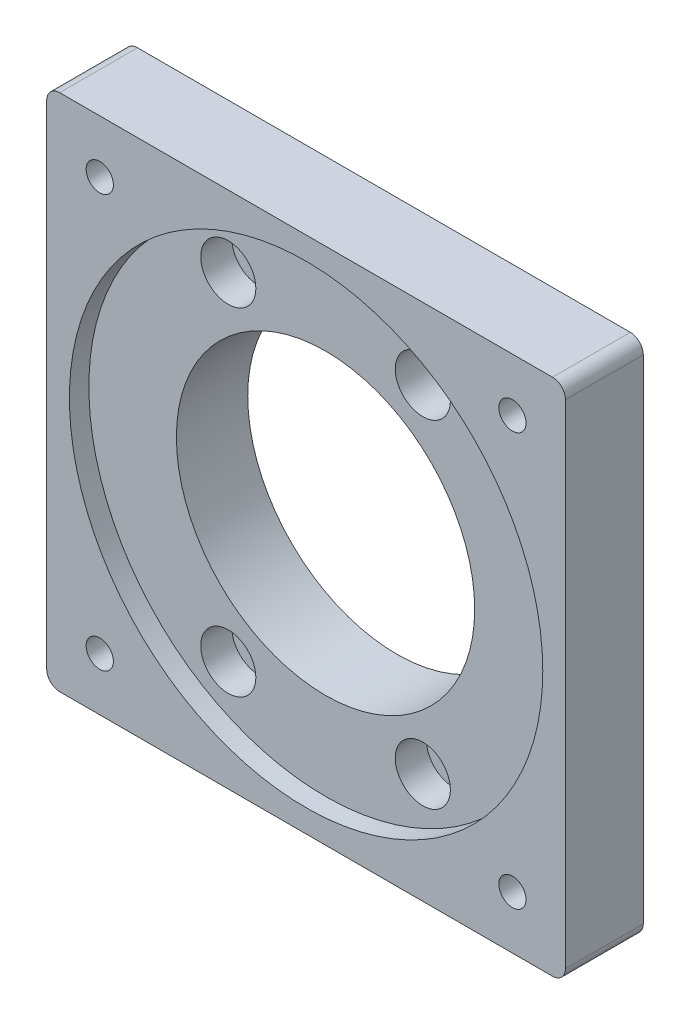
SolidWorks part; units mm, degrees
ref_plane "前视基准面" through (0, 0, 0) normal (0, 0, 1) x (1, 0, 0)
ref_plane "上视基准面" through (0, 0, 0) normal (0, 1, 0) x (1, 0, 0)
ref_plane "右视基准面" through (0, 0, 0) normal (1, 0, 0) x (0, 0, -1)
sketch "草图1" plane through (0, 0, 0) normal (0, 0, 1) x (1, 0, 0)
  line L1 (-40, -40) -> (40, -40)
  line L2 (-40, -40) -> (-40, 40)
  line L3 (-40, 40) -> (40, 40)
  line L4 (40, -40) -> (40, 40)
  line L5 (-40, -40) -> (40, 40) construction
  line L6 (-40, 40) -> (40, -40) construction
  circle A0 centre (0, 0) radius 23
  point P0 (0, 0)
  dimension "D3" = 46
  dimension "D1" = 80
  dimension "D2" = 80
extrude "凸台-拉伸1" add sketch "草图1" along normal blind 12
sketch "草图2" plane through (0, 0, 12) normal (0, 0, 1) x (1, 0, 0)
  line L0 (0, 40) -> (0, 0) construction
  line L1 (40, 40) -> (-40, 40) construction
  line L2 (0, 0) -> (-40, 0) construction
  line L3 (-40, 40) -> (-40, -40) construction
  line L4 (-31.8198, 31.8198) -> (31.8198, -31.8198) construction
  line L5 (31.8198, 31.8198) -> (-31.8198, -31.8198) construction
  circle A0 centre (-31.8198, 31.8198) radius 2.1
  circle A1 centre (31.8198, 31.8198) radius 2.1
  circle A2 centre (31.8198, -31.8198) radius 2.1
  circle A3 centre (-31.8198, -31.8198) radius 2.1
  circle A4 centre (0, 0) radius 45 construction
  dimension "D1" = 45
  dimension "D2" = 90
  dimension "D3" = 4.2
extrude "切除-拉伸1" cut sketch "草图2" against normal through all
sketch "草图3" plane through (0, 0, 12) normal (0, 0, 1) x (1, 0, 0)
  circle A0 centre (0, 0) radius 36.5
  dimension "D1" = 73
extrude "切除-拉伸2" cut sketch "草图3" against normal blind 3
sketch "草图5" plane through (0, 0, 9) normal (0, 0, 1) x (1, 0, 0)
  line L0 (0, 30) -> (0, 0) construction
  line L1 (0, 0) -> (-30, 0) construction
  line L2 (-15, 25.9808) -> (15, -25.9808) construction
  line L3 (15, 25.9808) -> (-15, -25.9808) construction
  circle A0 centre (0, 0) radius 30 construction
  circle A1 centre (-15, 25.9808) radius 2.25
  circle A2 centre (15, 25.9808) radius 2.25
  circle A3 centre (15, -25.9808) radius 2.25
  circle A4 centre (-15, -25.9808) radius 2.25
  dimension "D3" = 60
  dimension "D4" = 4.5
  dimension "D1" = 30
  dimension "D2" = 30
extrude "切除-拉伸3" cut sketch "草图5" against normal through all
sketch "草图6" plane through (0, 0, 9) normal (0, 0, 1) x (1, 0, 0)
  circle A0 centre (-15, 25.9808) radius 4.25
  circle A1 centre (15, 25.9808) radius 4.25
  circle A2 centre (15, -25.9808) radius 4.25
  circle A3 centre (-15, -25.9808) radius 4.25
  dimension "D1" = 8.5
extrude "切除-拉伸4" cut sketch "草图6" against normal blind 4.8
fillet "圆角1" radius 2 4 edges at (-40, 40, 6) (-40, -40, 6) (40, -40, 6) (40, 40, 6)
sketch "草图7" plane through (0, 0, 0) normal (0, 0, -1) x (-1, 0, 0)
  circle A0 centre (0, 0) radius 23 construction
  circle A1 centre (0, 0) radius 23
  circle A2 centre (0, 0) radius 25
  dimension "D1" = 50
extrude "凸台-拉伸2" add sketch "草图7" along normal blind 2
